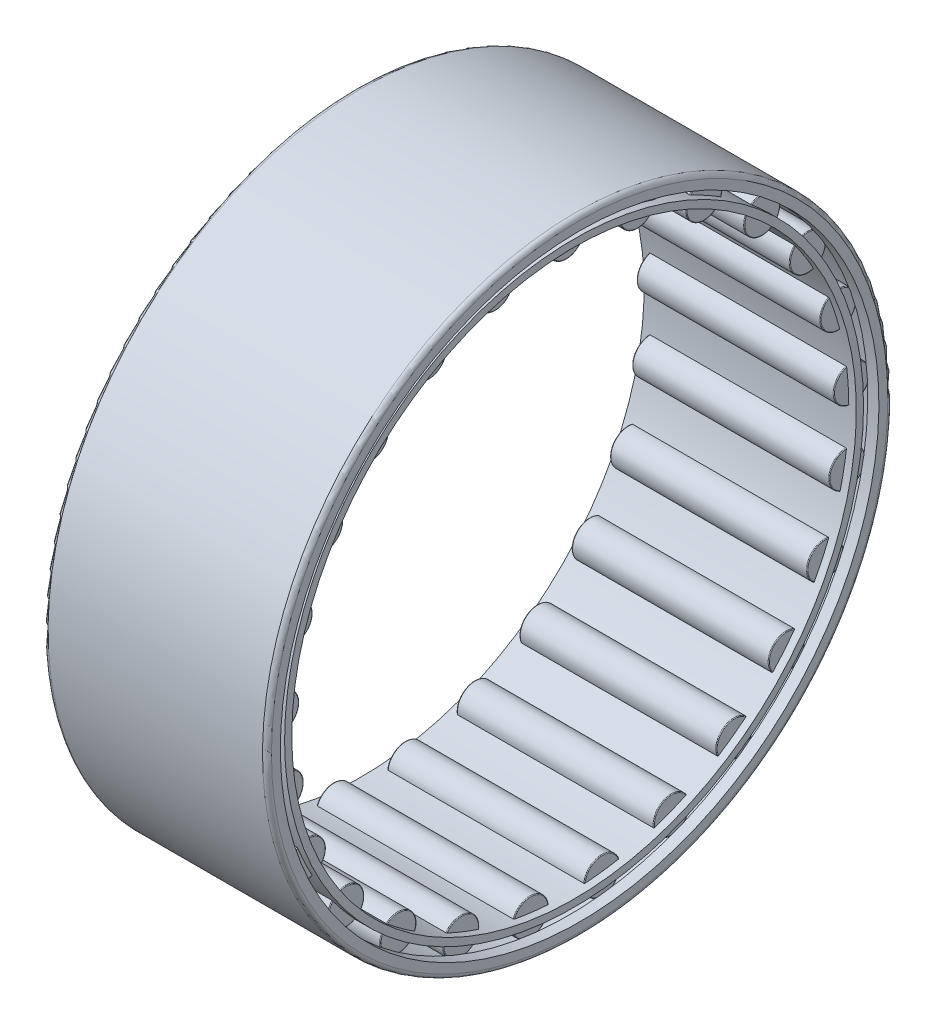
SolidWorks part; units mm, degrees
ref_plane "Plane1" through (0, 0, 0) normal (0, 0, 1) x (1, 0, 0)
ref_plane "Plane2" through (0, 0, 0) normal (0, 1, 0) x (1, 0, 0)
ref_plane "Plane3" through (0, 0, 0) normal (1, 0, 0) x (0, 0, -1)
other "Configuration Table"
sketch "Clipboard" plane through (0, 0, 0) normal (0, 0, 1) x (1, 0, 0)
  line L0 (-10, 0) -> (10, 0) construction
  line L1 (0, 0) -> (20.2657, -9.45)
  line L2 (0, 0) -> (36.8323, 17.1752)
  line L3 (0, 0) -> (20.2657, -9.45)
  line L4 (0, 0) -> (-76.2, -2.661)
sketch "InnRacSke" plane through (0, 0, 0) normal (0, 0, 1) x (1, 0, 0)
  line L0 (-14.2875, 42.545) -> (-15.875, 42.545)
  line L1 (-15.875, 42.545) -> (-15.875, 43.815)
  line L2 (-15.24, 44.45) -> (15.24, 44.45)
  line L4 (15.875, 43.815) -> (15.875, 42.545)
  line L5 (15.875, 42.545) -> (14.2875, 42.545)
  line L6 (14.2875, 42.545) -> (14.2875, 43.18)
  line L7 (14.2875, 43.18) -> (-14.2875, 43.18)
  line L8 (-14.2875, 43.18) -> (-14.2875, 42.545)
  line L9 (-31.75, 0) -> (31.75, 0) construction
  arc A0 (-15.875, 43.815) -> (-15.24, 44.45) centre (-15.24, 43.815) cw
  arc A2 (15.24, 44.45) -> (15.875, 43.815) centre (15.24, 43.815) cw
revolve "Race" add sketch "InnRacSke" angle 360 about L9
sketch "RolDetSke" plane through (0, 0, 0) normal (0, 0, 1) x (1, 0, 0)
  line L0 (-14.0018, 43.0906) -> (-14.0017, 40.64)
  line L1 (-14.0017, 40.64) -> (14.0017, 40.64)
  line L2 (14.0017, 40.64) -> (14.0018, 43.0906)
  line L3 (13.8996, 43.1927) -> (-13.8996, 43.1927)
  line L4 (-28.575, 40.64) -> (28.575, 40.64) construction
  arc A0 (14.0018, 43.0906) -> (13.8996, 43.1927) centre (13.8996, 43.0906) ccw
  arc A1 (-13.8996, 43.1927) -> (-14.0018, 43.0906) centre (-13.8996, 43.0906) ccw
revolve "RollerDetailed" add sketch "RolDetSke" angle 360 about L4
ref_axis "Axis1" through (-50, 0, 0) along (1, 0, 0)
sketch "CagSpiSke" plane through (0, 0, 0) normal (0, 0, 1) x (1, 0, 0)
  line L0 (15.0812, 40.1295) -> (15.0812, 41.1505)
  line L1 (15.0812, 41.1505) -> (-15.0813, 41.1505)
  line L2 (-15.0813, 41.1505) -> (-15.0813, 40.1295)
  line L3 (-15.0813, 40.1295) -> (15.0812, 40.1295)
  line L4 (-31.75, 0) -> (31.75, 0) construction
revolve "CageSpine" add sketch "CagSpiSke" angle 360 about L4
pattern_circular "RollersDetailed" count 25 every 14.4 about axis through (-50, 0, 0) along (1, 0, 0) of "RollerDetailed"
sketch "RolSimSke" plane through (0, 0, 0) normal (0, 0, 1) x (1, 0, 0)
  line L0 (-25.4, 0) -> (25.4, 0) construction
  line L2 (-13.8996, 43.2054) -> (13.8996, 43.2054)
  line L3 (-14.0018, 43.1033) -> (-14.0018, 38.2021)
  line L4 (-13.8996, 38.1) -> (13.8996, 38.1)
  line L5 (14.0017, 43.1033) -> (14.0017, 38.2021)
  arc A0 (-14.0018, 38.2021) -> (-13.8996, 38.1) centre (-13.8996, 38.2021) ccw
  arc A1 (-13.8996, 43.2054) -> (-14.0018, 43.1033) centre (-13.8996, 43.1033) ccw
  arc A2 (14.0017, 43.1033) -> (13.8996, 43.2054) centre (13.8996, 43.1033) ccw
  arc A3 (13.8996, 38.1) -> (14.0017, 38.2021) centre (13.8996, 38.2021) ccw
  point P10 (-14.0018, 38.1)
  point P15 (14.0017, 43.2054)
  point P18 (14.0017, 38.1)
revolve "RollersSimplified" [suppressed] add sketch "RolSimSke" angle 360 about L0
equation "\"BallCLRad@Clipboard\" =  ( \"D1@InnRacSke\" + \"Bore@Clipboard\" )  / 4"
equation "\"RollerCLRad@RolDetSke\" = \"BallCLRad@Clipboard\""
equation "\"halfCyl@InnRacSke\" = \"Cyl_Len@InnRacSke\" / 2"
equation "\"Roller_length@RolDetSke\" = \"Cyl_Len@InnRacSke\" * .98"
equation "\"halfLength@RolDetSke\" = \"Roller_length@RolDetSke\" / 2"
equation "\"Roller_diameter@RolDetSke\" =  ( \"D1@InnRacSke\" - \"Bore@Clipboard\" )  / 2 + .001"
equation "\"Roller_radius@RolDetSke\" = \"Roller_diameter@RolDetSke\" / 50"
equation "\"Cage_width@CagSpiSke\" =  ( \"Cyl_Len@InnRacSke\" + \"Width@InnRacSke\" )  / 2"
equation "\"halfWidth@CagSpiSke\" = \"Cage_width@CagSpiSke\" / 2"
equation "\"Cage_thickness@CagSpiSke\"  = \"Roller_diameter@RolDetSke\" / 5"
equation "\"D2@CagSpiSke\" =  \"RollerCLRad@RolDetSke\" * 2 - \"Cage_thickness@CagSpiSke\""
equation "\"Roller_length@RolSimSke\" = \"Cyl_Len@InnRacSke\" * .98"
equation "\"halfWidth@RolSimSke\" = \"Roller_length@RolSimSke\" / 2"
equation "\"D1@RolSimSke\" = \"Roller_radius@RolDetSke\""
equation "\"Roller_diameter@RolSimSke\" =  ( \"D1@InnRacSke\" - \"Bore@Clipboard\" )  / 2 + .001"
equation "\"Bore@RolSimSke\" = \"Bore@Clipboard\""
equation "\"Max_count@Clipboard\" = int( 3.14159265 / atn(( \"Roller_diameter@RolDetSke\" / 2) / sqr( \"RollerCLRad@RolDetSke\"  *  \"RollerCLRad@RolDetSke\" - ( \"Roller_diameter@RolDetSke\" / 2) *  ( \"Roller_diameter@R"
equation "\"Max_count@Clipboard\" = ((sgn( \"Max_count@Clipboard\" - \"Count@Clipboard\" )-1)*( \"Max_count@Clipboard\" - \"Count@Clipboard\" ))/-2+ \"Count@Clipboard\""
equation "\"Count@RollersDetailed\" = int( \"Show_count@Clipboard\" ) "
equation "\"Count@RollersDetailed\" = ((sgn( \"Count@RollersDetailed\" - \"Max_count@Clipboard\" )-1)*( \"Count@RollersDetailed\" - \"Max_count@Clipboard\" ))/-2+ \"Max_count@Clipboard\""
equation "\"Count@RollersDetailed\" = ((sgn( \"Count@RollersDetailed\" - \"Min_count@Clipboard\" )+1)*( \"Count@RollersDetailed\" - \"Min_count@Clipboard\"))/2 +\"Min_count@Clipboard\""
equation "\"Angle@RollersDetailed\" = 360.0 / \"Max_count@Clipboard\""
equation "\"Angle@CageSpine\" =  \"Angle@RollersDetailed\" * ( \"Count@RollersDetailed\" -1 + int( \"Count@RollersDetailed\" / \"Max_count@Clipboard\" ) )  + 0.001 -  int( \"Count@RollersDetailed\" / \"Max_count@Clipboard\" "
equation "\"Angle@CageSpine\" =  \"Angle@CageSpine\" * int( \"Min_count@Clipboard\" / 2) + int(1 / \"Min_count@Clipboard\")  * 0.001"
